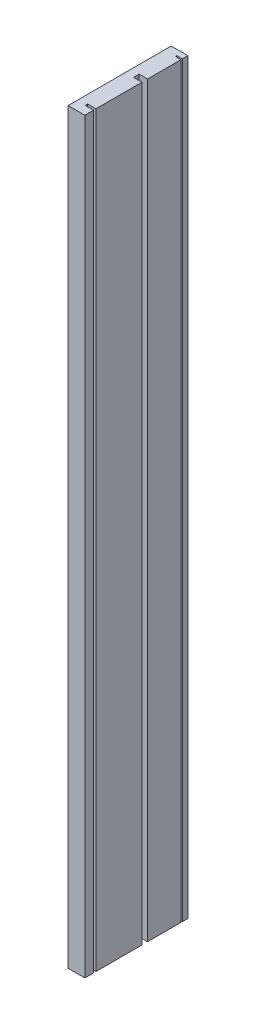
SolidWorks part; units mm, degrees
ref_plane "Front Plane" through (0, 0, 0) normal (0, 0, 1) x (1, 0, 0)
ref_plane "Top Plane" through (0, 0, 0) normal (0, 1, 0) x (1, 0, 0)
ref_plane "Right Plane" through (0, 0, 0) normal (1, 0, 0) x (0, 0, -1)
sketch "Sketch2" plane through (0, 0, 0) normal (1, 0, 0) x (0, 0, -1)
  line L1 (0, 0) -> (234.95, 0)
  line L2 (0, 0) -> (0, 1219.2)
  line L3 (0, 1219.2) -> (234.95, 1219.2)
  line L4 (234.95, 0) -> (234.95, 1219.2)
extrude "Boss-Extrude1" add sketch "Sketch2" along normal mid plane 38.1
sketch "Sketch3" plane through (0, 1219.2, 0) normal (0, 1, 0) x (1, 0, 0)
  line L0 (19.05, 25.4) -> (0, 25.4)
  line L1 (0, 19.812) -> (19.05, 19.812)
  line L2 (19.05, 234.95) -> (19.05, 0) construction
  line L3 (0, 25.4) -> (0, 19.812)
  line L4 (0, 12.7) -> (19.05, 12.7) construction
  line L5 (19.05, 25.4) -> (19.05, 19.812)
  line L6 (19.05, 0) -> (-19.05, 0) construction
  line L7 (19.05, 130.175) -> (19.05, 142.875)
  line L8 (19.05, 142.875) -> (0, 142.875)
  line L9 (0, 142.875) -> (0, 130.175)
  line L10 (0, 130.175) -> (19.05, 130.175)
  line L11 (19.05, 222.25) -> (19.05, 219.075)
  line L12 (19.05, 219.075) -> (6.35, 219.075)
  line L13 (6.35, 219.075) -> (6.35, 222.25)
  line L14 (6.35, 222.25) -> (19.05, 222.25)
  line L15 (0, 19.812) -> (0, 12.7) construction
  line L16 (19.05, 19.812) -> (19.05, 12.7) construction
extrude "Cut-Extrude1" cut sketch "Sketch3" against normal through all
sketch "Sketch4" plane through (0, 0, 0) normal (0, -1, 0) x (1, 0, 0)
  line L16 (0, -25.4) -> (0, -19.812)
  line L17 (0, -25.4) -> (0, -19.812)
  line L18 (19.05, -19.812) -> (19.05, 0)
  line L19 (19.05, 0) -> (-19.05, 0)
  line L20 (-19.05, 0) -> (-19.05, -234.95)
  line L21 (-19.05, -234.95) -> (19.05, -234.95)
  line L22 (19.05, -234.95) -> (19.05, -222.25)
  line L23 (19.05, -234.95) -> (19.05, -222.25)
  line L24 (19.05, -222.25) -> (6.35, -222.25)
  line L25 (19.05, -222.25) -> (6.35, -222.25)
  line L26 (6.35, -222.25) -> (6.35, -219.075)
  line L27 (6.35, -222.25) -> (6.35, -219.075)
  line L28 (6.35, -219.075) -> (19.05, -219.075)
  line L29 (6.35, -219.075) -> (19.05, -219.075)
  line L30 (19.05, -219.075) -> (19.05, -142.875)
  line L31 (19.05, -219.075) -> (19.05, -142.875)
  line L34 (19.05, -19.812) -> (19.05, 0)
  line L35 (19.05, 0) -> (-19.05, 0)
  line L36 (-19.05, 0) -> (-19.05, -234.95)
  line L37 (-19.05, -234.95) -> (19.05, -234.95)
  line L48 (19.05, -142.875) -> (0, -142.875)
  line L49 (19.05, -142.875) -> (0, -142.875)
  line L50 (0, -142.875) -> (0, -130.175)
  line L51 (0, -142.875) -> (0, -130.175)
  line L52 (0, -130.175) -> (19.05, -130.175)
  line L53 (0, -130.175) -> (19.05, -130.175)
  line L54 (19.05, -130.175) -> (19.05, -25.4)
  line L55 (19.05, -130.175) -> (19.05, -25.4)
  line L56 (19.05, -25.4) -> (0, -25.4)
  line L57 (19.05, -25.4) -> (0, -25.4)
  line L58 (0, -19.812) -> (19.05, -19.812)
  line L59 (0, -19.812) -> (19.05, -19.812)
  dimension "D1" = 0
extrude "Boss-Extrude2" add sketch "Sketch4" along normal offset from surface (482.6 mm away) 304.8
equation "\"depth_of_plinko\"= 9.25'wood 2x10"
equation "\"D1@Sketch2\"=\"depth_of_plinko\""
equation "\"Height_of_Plinko\"= 48'plywood sheet 3ftx4ft 3/4in thick"
equation "\"D2@Sketch2\"=\"Height_of_Plinko\""
equation "\"bit_diameter\"=0.5"
equation "\"D2@Sketch3\"=\"bit_diameter\""
equation "\"Pole_area\"=5.5"
